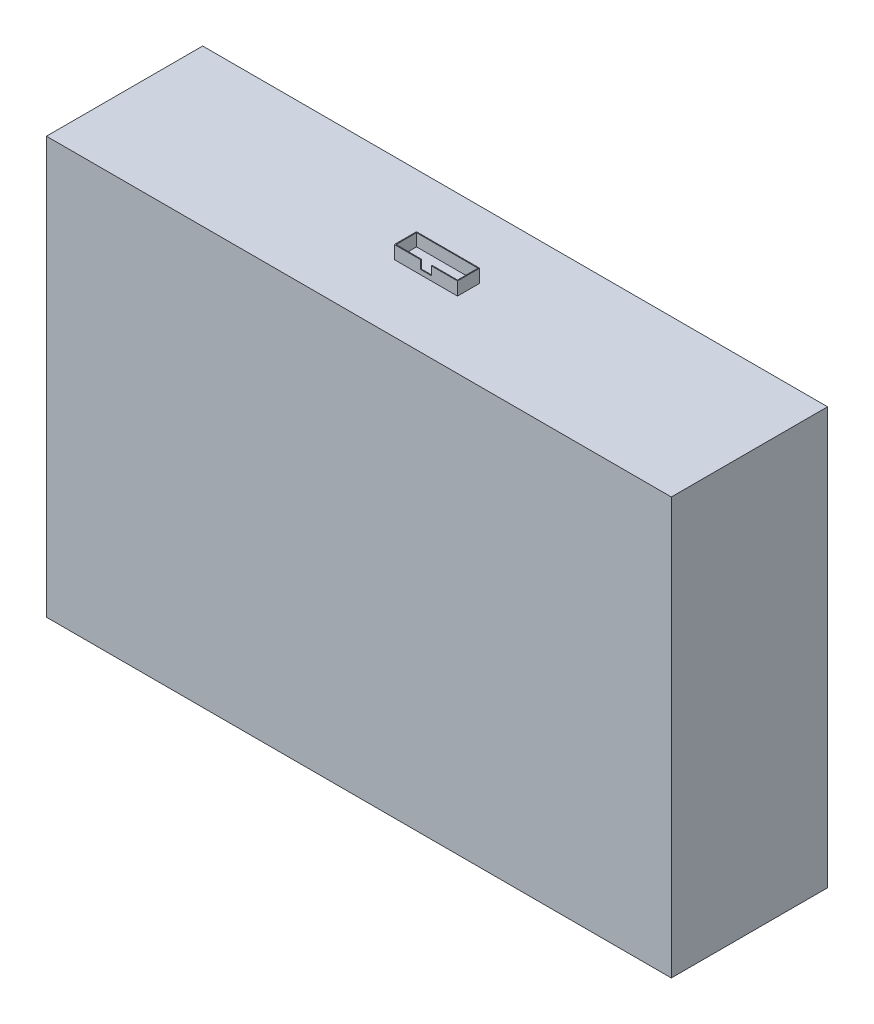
SolidWorks part; units mm, degrees
ref_plane "Front" through (0, 0, 0) normal (0, 0, 1) x (1, 0, 0)
ref_plane "Top" through (0, 0, 0) normal (0, 1, 0) x (1, 0, 0)
ref_plane "Right" through (0, 0, 0) normal (1, 0, 0) x (0, 0, -1)
sketch "Sketch1" plane through (0, 0, 0) normal (0, 1, 0) x (1, 0, 0)
  line L0 (0, 0) -> (0, 5) construction
  line L1 (-15, 5) -> (15, 5)
  line L2 (-15, 5) -> (-15, -5)
  line L3 (-15, -5) -> (15, -5)
  line L4 (15, 5) -> (15, -5)
  line L5 (0, 0) -> (15, 0) construction
  dimension "D1" = 30
  dimension "D2" = 10
extrude "Extrude1" add sketch "Sketch1" along normal blind 6
shell "Shell1" thickness 0.4
sketch "Sketch2" plane through (0, 0, 5) normal (0, 0, -1) x (-1, 0, 0)
  line L0 (-2.625, 6) -> (-2.625, 1.8486)
  line L1 (15, 6) -> (-15, 6) construction
  line L2 (0, 6) -> (0, 5.4905) construction
  line L3 (2.625, 6) -> (2.625, 1.8486)
  line L4 (-2.625, 1.8486) -> (2.625, 1.8486)
  line L5 (-2.625, 6) -> (2.625, 6)
  dimension "D2" = 5.25
extrude "Cut-Extrude1" cut sketch "Sketch2" against normal up to surface (0.4 mm away)
sketch "Sketch3" plane through (0, -0.4, 0) normal (0, -1, 0) x (1, 0, 0)
  line L0 (-152.4, 0) -> (152.4, 0) construction
  line L1 (-152.4, 38.1) -> (152.4, 38.1)
  line L2 (-152.4, 38.1) -> (-152.4, -38.1)
  line L3 (-152.4, -38.1) -> (152.4, -38.1)
  line L4 (152.4, 38.1) -> (152.4, -38.1)
  dimension "D1" = 304.8
  dimension "D2" = 76.2
extrude "Extrude2" add sketch "Sketch3" along normal blind 203.2
sketch "Sketch4" plane through (0, -203.6, 0) normal (0, -1, 0) x (1, 0, 0)
  line L0 (-102.4112, 0) -> (0, 0) construction
  circle A0 centre (-102.4112, 0) radius 21
  dimension "D1" = 42
extrude "Extrude3" add sketch "Sketch4" along normal blind 10
